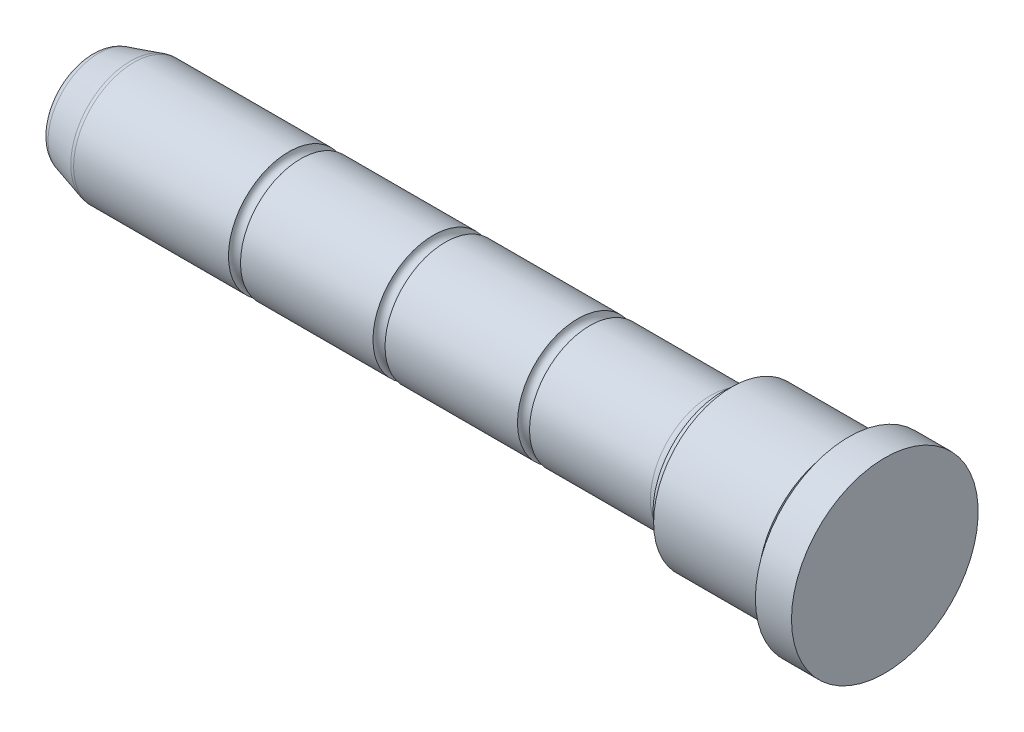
SolidWorks part; units mm, degrees
ref_plane "Face" through (0, 0, 0) normal (0, 0, 1) x (1, 0, 0)
ref_plane "Dessus" through (0, 0, 0) normal (0, 1, 0) x (1, 0, 0)
ref_plane "Droite" through (0, 0, 0) normal (1, 0, 0) x (0, 0, -1)
sketch "Esquisse2" plane through (0, 0, 0) normal (0, 0, 1) x (1, 0, 0)
  line L0 (0, 0) -> (146.8071, 0) construction
  line L1 (0, 0) -> (0, 10)
  line L2 (0, 10) -> (33, 10)
  line L6 (35, 10) -> (57, 10)
  line L10 (59, 10) -> (81, 10)
  line L14 (83, 10) -> (105, 10)
  line L15 (106.6039, 11.5) -> (106.6039, 13)
  line L16 (106.6039, 13) -> (124, 13)
  line L17 (124, 13) -> (124, 12.5)
  line L18 (124.5, 12) -> (125, 12)
  line L19 (126, 13) -> (126, 15.5)
  line L20 (126, 15.5) -> (132, 15.5)
  line L21 (132, 15.5) -> (132, 0)
  line L22 (105, 10) -> (105, 11.5)
  line L23 (105, 11.5) -> (106.6039, 11.5)
  line L24 (0, 0) -> (132, 0)
  arc A0 (33, 10) -> (35, 10) centre (34, 10) ccw
  arc A1 (57, 10) -> (59, 10) centre (58, 10) ccw
  arc A2 (83, 10) -> (81, 10) centre (82, 10) cw
  arc A3 (125, 12) -> (126, 13) centre (125, 13) ccw
  arc A4 (124, 12.5) -> (124.5, 12) centre (124.5, 12.5) ccw
  dimension "D5" = 1
  dimension "D6" = 1
  dimension "D4" = 1
  dimension "D7" = 1
  dimension "D14" = 0.5
  dimension "D1" = 15.5
  dimension "D2" = 13
  dimension "D3" = 10
  dimension "D8" = 12
  dimension "D9" = 2
  dimension "D10" = 6
  dimension "D11" = 105
  dimension "D12" = 27
  dimension "D13" = 22
revolve "Révolution1" add sketch "Esquisse2" angle 360 about L0
chamfer "Chanfrein1" distance 7 distance2 2 1 edges at (0, 0, 10)
fillet "Congé1" radius 2 1 edges at (0, 0, -8)
fillet "Congé2" radius 2 1 edges at (7, 0, -10)
fillet "Congé3" radius 2 1 edges at (105, 0, 10)
